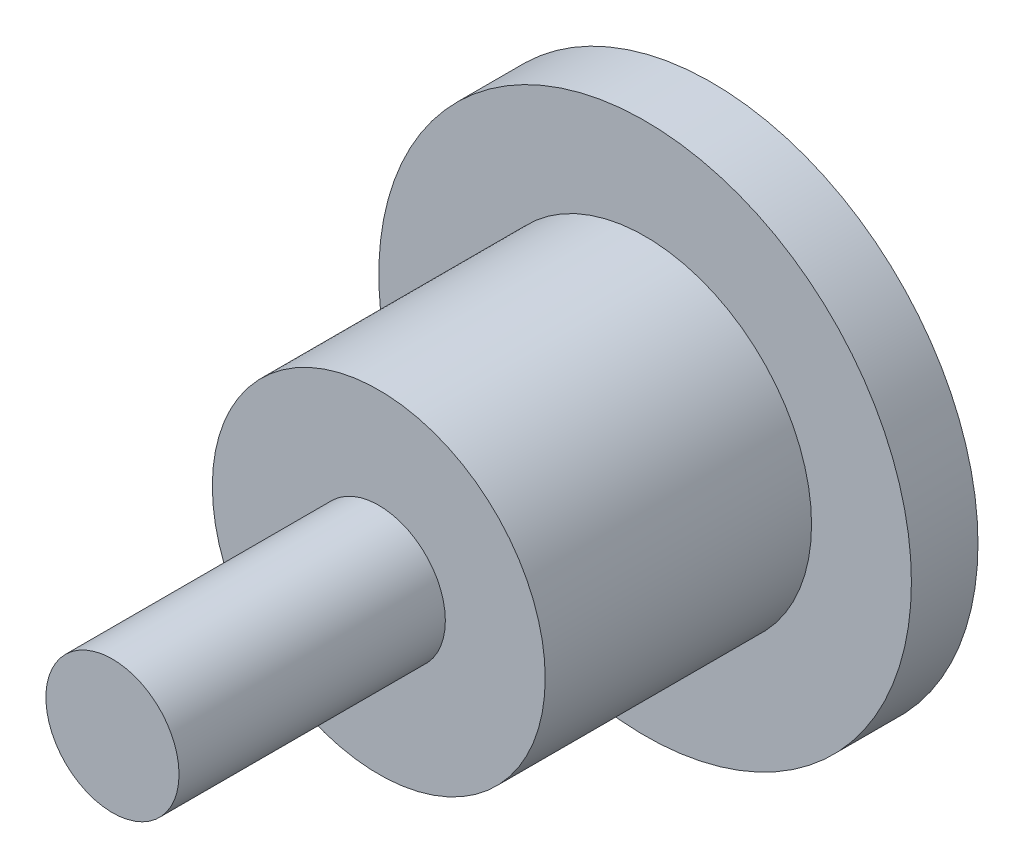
SolidWorks part; units mm, degrees
ref_plane "前视基准面" through (0, 0, 0) normal (0, 0, 1) x (1, 0, 0)
ref_plane "上视基准面" through (0, 0, 0) normal (0, 1, 0) x (1, 0, 0)
ref_plane "右视基准面" through (0, 0, 0) normal (1, 0, 0) x (0, 0, -1)
sketch "草图1" plane through (0, 0, 0) normal (0, 0, 1) x (1, 0, 0)
  circle A0 centre (0, 0) radius 2
  dimension "D1" = 4
extrude "凸台-拉伸1" add sketch "草图1" along normal blind 0.5
sketch "草图2" plane through (0, 0, 0.5) normal (0, 0, 1) x (1, 0, 0)
  circle A0 centre (0, 0) radius 1.25
  dimension "D1" = 2.5
extrude "凸台-拉伸2" add sketch "草图2" along normal blind 2
sketch "草图3" plane through (0, 0, 2.5) normal (0, 0, 1) x (1, 0, 0)
  circle A0 centre (0, 0) radius 0.5
  dimension "D1" = 1
extrude "凸台-拉伸3" add sketch "草图3" along normal blind 2
